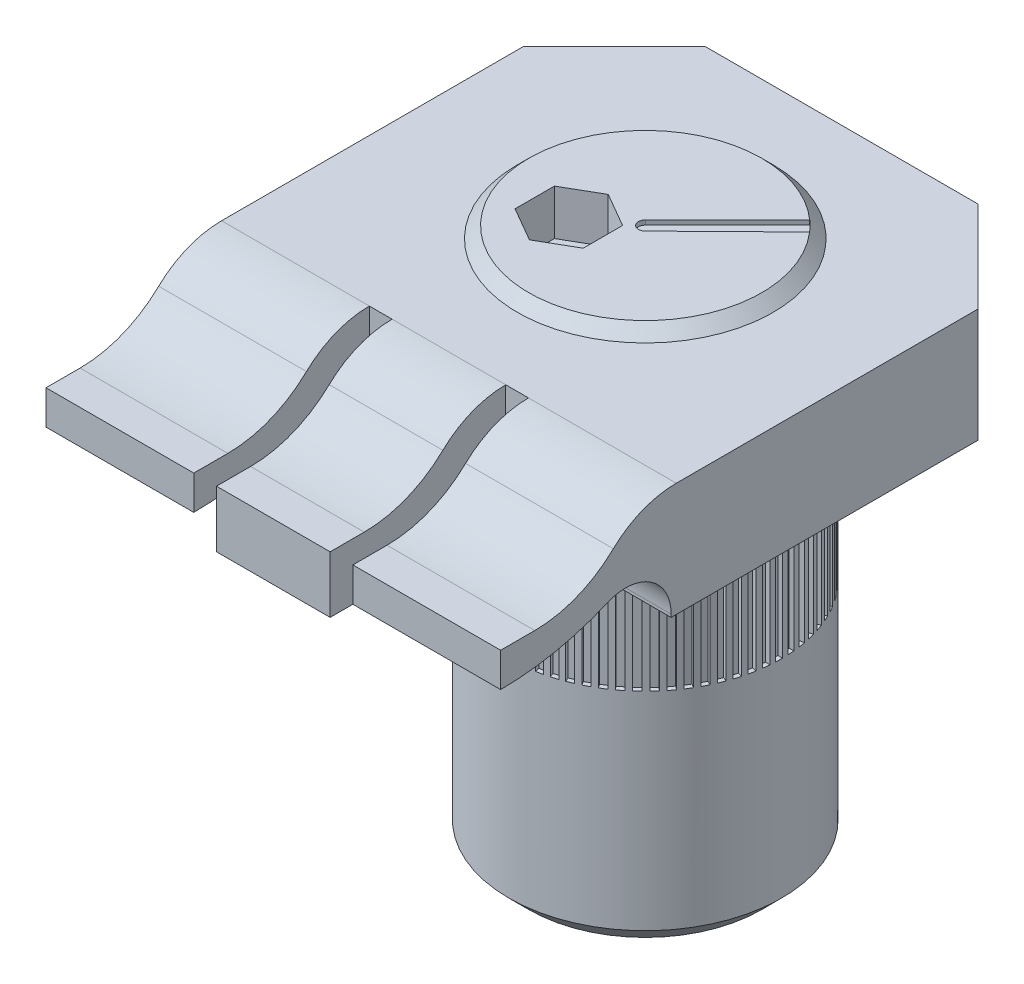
SolidWorks part; units mm, degrees
ref_plane "Front Plane" through (0, 0, 0) normal (0, 0, 1) x (1, 0, 0)
ref_plane "Top Plane" through (0, 0, 0) normal (0, 1, 0) x (1, 0, 0)
ref_plane "Right Plane" through (0, 0, 0) normal (1, 0, 0) x (0, 0, -1)
sketch "Sketch1" plane through (0, 0, 0) normal (1, 0, 0) x (0, 0, -1)
  line L0 (12.5, 0) -> (-12.5, 0)
  line L1 (-12.5, 0) -> (-12.5, 2.5)
  line L2 (-12.5, 2.5) -> (-11, 2.5)
  line L3 (-4.7751, 5) -> (12.5, 5)
  line L4 (12.5, 5) -> (12.5, 0)
  arc A0 (-11, 2.5) -> (-7.5417, 3.8889) centre (-11, 7.5) ccw
  arc A1 (-7.5417, 3.8889) -> (-4.7751, 5) centre (-4.7751, 1) cw
  point P9 (0, 0)
  point P11 (0, 0)
  dimension "D4" = 5
  dimension "D5" = 4
  dimension "D1" = 25
  dimension "D2" = 5
  dimension "D3" = 2.5
  dimension "D6" = 1.5
extrude "Boss-Extrude1" add sketch "Sketch1" along normal mid plane 20
sketch "Sketch2" plane through (0, 0, 0) normal (0, 1, 0) x (1, 0, 0)
  line L0 (10, -12.5) -> (-10, -12.5) construction
  line L1 (-3.5, -4.7751) -> (-2.5, -4.7751)
  line L2 (-3.5, -4.7751) -> (-3.5, -12.5)
  line L3 (-3.5, -12.5) -> (-2.5, -12.5)
  line L4 (-2.5, -4.7751) -> (-2.5, -12.5)
  line L5 (-3.5, -4.7751) -> (-2.5, -12.5) construction
  line L6 (-3.5, -12.5) -> (-2.5, -4.7751) construction
  line L7 (10, -4.7751) -> (-10, -4.7751) construction
  line L8 (-10, -7.5417) -> (-10, -11) construction
  point P0 (-3, -8.6375)
  dimension "D1" = 1
  dimension "D2" = 7
extrude "Cut-Extrude1" cut sketch "Sketch2" along normal up to surface (5 mm away)
mirror "Mirror1" about plane through (0, 0, 0) normal (1, 0, 0) of "Cut-Extrude1"
sketch "Sketch7" plane through (10, 0, 0) normal (1, 0, 0) x (0, 0, -1)
  line L0 (-12.5, 0) -> (-12.5, 1)
  line L1 (-12.5, 2.5) -> (-12.5, 0) construction
  line L2 (-5, 0.1256) -> (-5, 0)
  line L3 (-12.5, 0) -> (12.5, 0) construction
  line L4 (-5, 0) -> (-12.5, 0)
  arc A0 (-12.5, 1) -> (-7.7857, 1.9648) centre (-12.5, 13) ccw
  arc A1 (-7.7857, 1.9648) -> (-5, 0.1256) centre (-7, 0.1256) cw
  dimension "D2" = 12
  dimension "D4" = 2
  dimension "D1" = 1
  dimension "D3" = 7.5
extrude "Cut-Extrude2" cut sketch "Sketch7" against normal up to surface (6.5 mm away)
sketch "Sketch8" plane through (-10, 0, 0) normal (-1, 0, 0) x (0, 0, 1)
  line L0 (12.5, 1) -> (12.5, 0)
  line L1 (12.5, 0) -> (5, 0)
  line L2 (5, 0) -> (5, 0.1256)
  arc A0 (5, 0.1256) -> (7.7857, 1.9648) centre (7, 0.1256) cw
  arc A1 (7.7857, 1.9648) -> (12.5, 1) centre (12.5, 13) ccw
extrude "Cut-Extrude3" cut sketch "Sketch8" against normal up to surface (6.5 mm away)
sketch "Sketch9" plane through (0, 0, 0) normal (0, -1, 0) x (1, 0, 0)
  line L0 (10, -12.5) -> (-10, -12.5) construction
  line L1 (2.5, 4.7751) -> (3.5, 4.7751) construction
  line L2 (10, 5) -> (10, -12.5) construction
  circle A0 centre (0, -3.8625) radius 8.6375
  point P4 (3, 4.7751)
  point P5 (0, 4.7751)
  dimension "D1" = 10
extrude "Boss-Extrude2" add sketch "Sketch9" along normal blind 0.001
sketch "Sketch10" plane through (0, -0.001, 0) normal (0, -1, 0) x (1, 0, 0)
  circle A0 centre (0, -3.8625) radius 6
  dimension "D1" = 12
extrude "Boss-Extrude3" add sketch "Sketch10" along normal blind 18
chamfer "Chamfer1" distance 0.875 angle 45 1 edges at (0, -18.001, -9.8625)
sketch "Sketch13" plane through (0, 0, 0) normal (1, 0, 0) x (0, 0, -1)
  line L0 (3.8625, -18.7589) -> (3.8625, -9.8312) construction
sketch "Sketch14" plane through (0, 0, 0) normal (1, 0, 0) x (0, 0, -1)
  line L0 (3.8625, -18.001) -> (-0.1375, -18.001)
  line L1 (-1.2625, -18.001) -> (8.9875, -18.001) construction
  line L2 (-0.1375, -18.001) -> (-0.1375, -18.501)
  line L3 (-0.1375, -18.501) -> (0.3625, -18.501)
  line L4 (0.3625, -18.501) -> (0.3625, -19.001)
  line L5 (0.3625, -19.001) -> (3.8625, -19.001)
  line L6 (3.8625, -19.001) -> (3.8625, -18.001)
  line L7 (3.8625, -18.7589) -> (3.8625, -9.8312) construction
  dimension "D1" = 0.5
  dimension "D2" = 4
revolve "Revolve1" add sketch "Sketch14" angle 360 about L0
ref_plane "Plane1" through (6, 0, 0) normal (1, 0, 0) x (0, 0, -1)
sketch "Sketch15" plane through (6, 0, 0) normal (1, 0, 0) x (0, 0, -1)
  line L0 (-2.1375, -0.001) -> (9.8625, -0.001) construction
  line L1 (3.6, -8.001) -> (3.9, -8.001)
  line L2 (3.6, -8.001) -> (3.6, -0.001)
  line L3 (3.6, -0.001) -> (3.9, -0.001)
  line L4 (3.9, -8.001) -> (3.9, -0.001)
  line L5 (3.6, -8.001) -> (3.9, -0.001) construction
  line L6 (3.6, -0.001) -> (3.9, -8.001) construction
  line L7 (-5, 0) -> (12.5, 0) construction
  point P0 (3.75, -4.001)
  point P7 (3.75, -8.001)
  point P8 (3.75, 0)
  point P9 (3.75, -0.001)
  dimension "D1" = 0.3
  dimension "D2" = 8
extrude "Cut-Extrude4" cut sketch "Sketch15" against normal blind 0.2
pattern_circular "CirPattern1" count 70 over 360 about axis through (0, 0, -3.8625) along (0, 1, 0) of "Cut-Extrude4"
sketch "Sketch16" plane through (0, 5, 0) normal (0, 1, 0) x (1, 0, 0)
  line L0 (-10, 12.5) -> (-10, -4.7751) construction
  line L1 (10, 12.5) -> (10, -4.7751) construction
  circle A0 centre (0, 3.8625) radius 6
  point P4 (6, 3.8625)
  point P5 (10, 3.8625)
  dimension "D1" = 12
  dimension "D2" = 10
extrude "Boss-Extrude4" add sketch "Sketch16" along normal blind 0.5
chamfer "Chamfer2" distance 0.875 angle 45 1 edges at (0, 5.5, 2.1375)
sketch "Sketch17" plane through (0, 5.5, 0) normal (0, 1, 0) x (1, 0, 0)
  line L0 (10, -12.5) -> (3.5, -12.5) construction
  line L1 (-2, 4.2321) -> (-3.5, 3.366)
  line L2 (-3.5, 3.366) -> (-3.5, 1.634)
  line L3 (-3.5, 1.634) -> (-2, 0.7679)
  line L4 (-2, 0.7679) -> (-0.5, 1.634)
  line L5 (-0.5, 1.634) -> (-0.5, 3.366)
  line L6 (-0.5, 3.366) -> (-2, 4.2321)
  line L7 (-10, 12.5) -> (-10, -4.7751) construction
  circle A0 centre (-2, 2.5) radius 1.5 construction
  circle A1 centre (0, 3.8625) radius 5.125 construction
  dimension "D1" = 3
  dimension "D2" = 15
  dimension "D3" = 8
extrude "Cut-Extrude5" cut sketch "Sketch17" against normal blind 2
sketch "Sketch18" plane through (0, 5.5, 0) normal (0, 1, 0) x (1, 0, 0)
  line L0 (-0.2121, 4.0746) -> (3.4056, 7.6923)
  line L2 (0.21, 3.6482) -> (3.8637, 7.2296)
  line L3 (10, 12.5) -> (-10, 12.5) construction
  line L7 (-0.5, 1.634) -> (-0.5, 3.366) construction
  arc A0 (-0.2121, 4.0746) -> (0.21, 3.6482) centre (0, 3.8625) ccw
  arc A1 (3.8637, 7.2296) -> (3.4056, 7.6923) centre (0, 3.8625) ccw
  circle A2 centre (0, 3.8625) radius 5.125 construction
  point P7 (0, 0)
  point P10 (0, 3.8625)
  point P11 (5.125, 3.8625)
  point P13 (0, 3.8625)
  dimension "D2" = 0.3
  dimension "D1" = 45
  dimension "D3" = 0.71
extrude "Cut-Extrude6" cut sketch "Sketch18" against normal blind 0.2
chamfer "Chamfer3" distance 4 angle 45 2 edges at (-10, 2.5, -12.5) (10, 2.5, -12.5)
